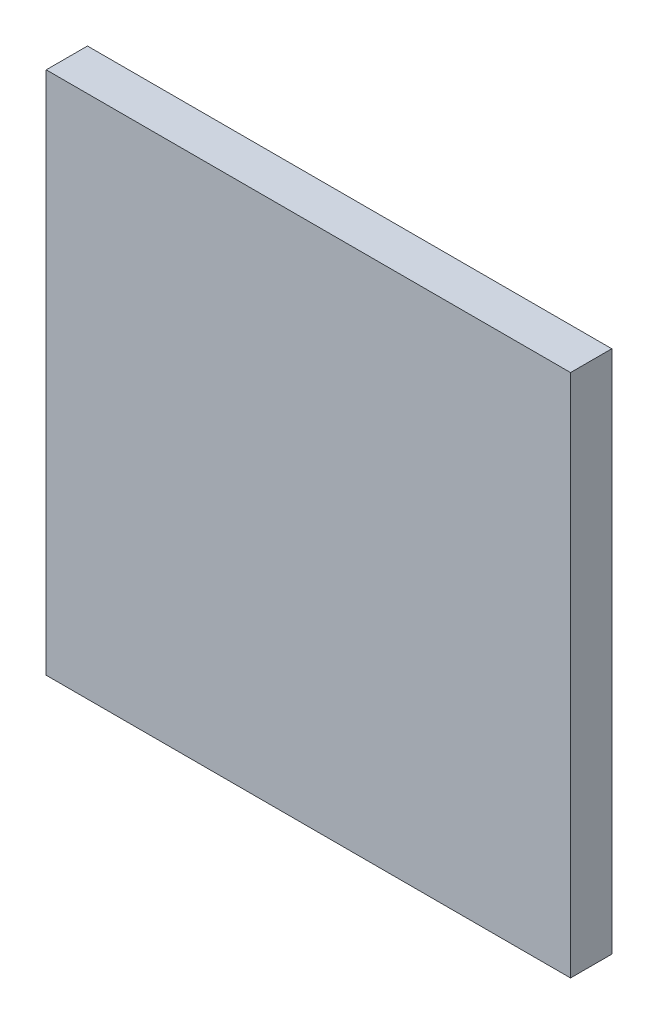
SolidWorks part; units mm, degrees
ref_plane "Front Plane" through (0, 0, 0) normal (0, 0, 1) x (1, 0, 0)
ref_plane "Top Plane" through (0, 0, 0) normal (0, 1, 0) x (1, 0, 0)
ref_plane "Right Plane" through (0, 0, 0) normal (1, 0, 0) x (0, 0, -1)
sketch "Sketch1" plane through (0, 0, 0) normal (0, 0, 1) x (1, 0, 0)
  line L1 (0, 0) -> (38.1, 0)
  line L2 (0, 0) -> (0, 38.1)
  line L3 (0, 38.1) -> (38.1, 38.1)
  line L4 (38.1, 0) -> (38.1, 38.1)
extrude "Boss-Extrude1" add sketch "Sketch1" along normal blind 2.9972
